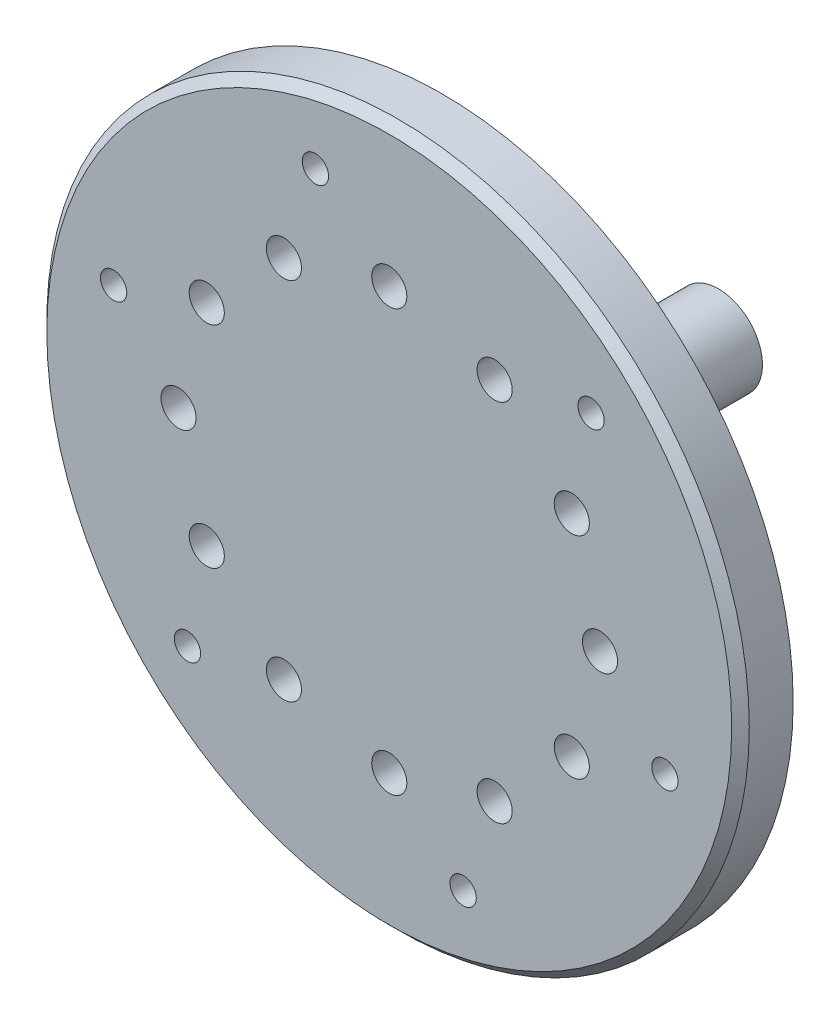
SolidWorks part; units mm, degrees
ref_plane "Face" through (0, 0, 0) normal (0, 0, 1) x (1, 0, 0)
ref_plane "Dessus" through (0, 0, 0) normal (0, 1, 0) x (1, 0, 0)
ref_plane "Droite" through (0, 0, 0) normal (1, 0, 0) x (0, 0, -1)
sketch "Esquisse1" plane through (0, 0, 0) normal (0, 0, 1) x (1, 0, 0)
  circle A0 centre (0, 0) radius 80
  dimension "D1" = 160
extrude "Base-Extrusion" add sketch "Esquisse1" along normal blind 12
chamfer "Chanfrein1" distance 2 angle 45
sketch "Esquisse2" plane through (0, 0, 0) normal (0, 0, -1) x (-1, 0, 0)
  circle A0 centre (0, 0) radius 12.5
  circle A1 centre (0, 0) radius 80 construction
  dimension "D1" = 25
extrude "Boss.-Extru.1" add sketch "Esquisse2" along normal blind 10
sketch "Esquisse3" plane through (0, 0, 12) normal (0, 0, 1) x (1, 0, 0)
  line L0 (0, 0) -> (-65.5513, 0) construction
  circle A0 centre (0, 0) radius 48 construction
  circle A1 centre (-48, 0) radius 4
  dimension "D1" = 96
  dimension "D2" = 8
extrude "Enlèv. mat.-Extru.1" cut sketch "Esquisse3" against normal through all
pattern_circular "Répétition circulaire1" count 12 over 360
sketch "Esquisse4" plane through (0, 0, 12) normal (0, 0, 1) x (1, 0, 0)
  line L0 (0, 0) -> (-94.0952, 0) construction
sketch "Esquisse5" plane through (0, 0, 12) normal (0, 0, 1) x (1, 0, 0)
  line L0 (0, 0) -> (-94.0952, 0) construction
  line L1 (0, 0) -> (-94.0778, 25.2081) construction
  circle A0 centre (0, 0) radius 65 construction
  circle A1 centre (-62.7852, 16.8232) radius 3
  dimension "D1" = 130
  dimension "D2" = 15
  dimension "D3" = 6
extrude "Enlèv. mat.-Extru.2" cut sketch "Esquisse5" against normal through all
pattern_circular "Répétition circulaire2" count 6 over 360
sketch "Esquisse6" plane through (0, 0, -10) normal (0, 0, -1) x (-1, 0, 0)
  circle A0 centre (0, 0) radius 10
  circle A1 centre (0, 0) radius 12.5 construction
  dimension "D1" = 20
extrude "Boss.-Extru.2" add sketch "Esquisse6" along normal blind 53
